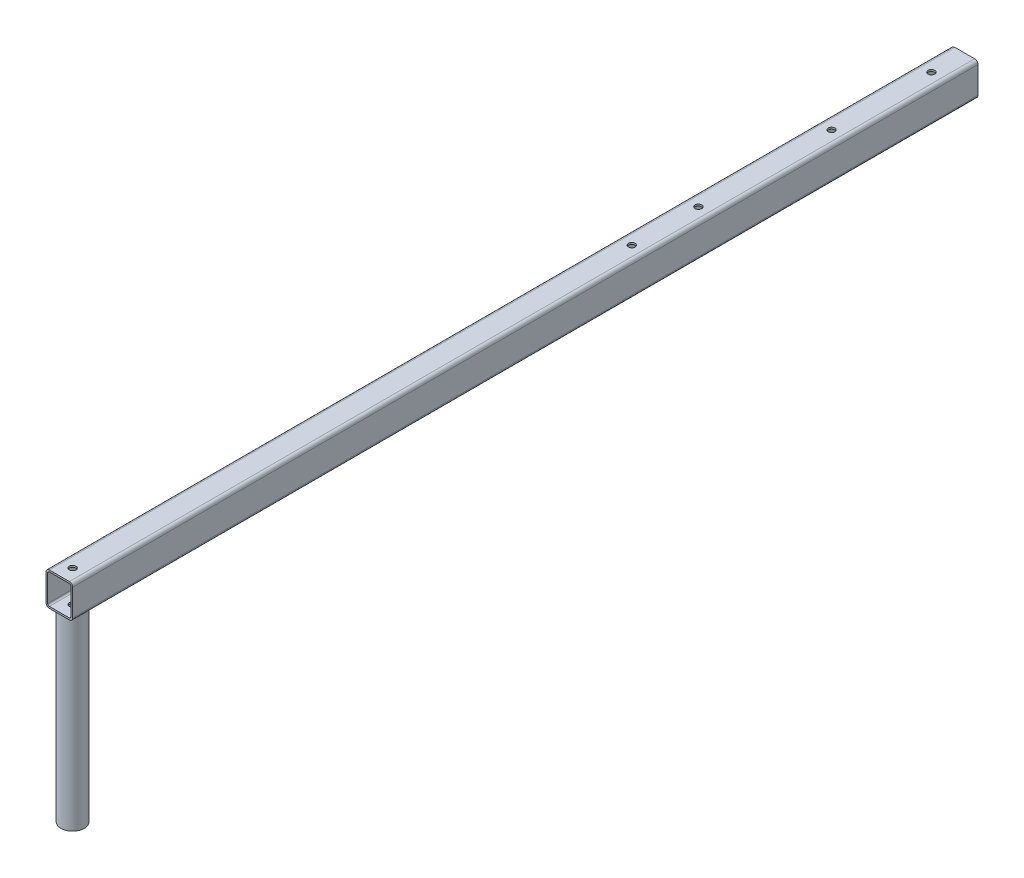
SolidWorks part; units mm, degrees
ref_plane "Front Plane" through (0, 0, 0) normal (0, 0, 1) x (1, 0, 0)
ref_plane "Top Plane" through (0, 0, 0) normal (0, 1, 0) x (1, 0, 0)
ref_plane "Right Plane" through (0, 0, 0) normal (1, 0, 0) x (0, 0, -1)
sketch "Sketch1" plane through (0, 0, 0) normal (0, 0, 1) x (1, 0, 0)
  line L1 (12.7, 15.875) -> (-12.7, 15.875)
  line L2 (12.7, 15.875) -> (12.7, -15.875)
  line L3 (12.7, -15.875) -> (-12.7, -15.875)
  line L4 (-12.7, 15.875) -> (-12.7, -15.875)
  line L5 (12.7, 15.875) -> (-12.7, -15.875) construction
  line L6 (12.7, -15.875) -> (-12.7, 15.875) construction
  point P0 (0, 0)
  dimension "D1" = 25.4
  dimension "D2" = 31.75
extrude "Extrude-Thin1" add sketch "Sketch1" along normal blind 863.6 thin
fillet "Fillet1" radius 3.175 4 edges at (12.7, -15.875, 431.8) (-12.7, -15.875, 431.8) (-12.7, 15.875, 431.8) (12.7, 15.875, 431.8)
fillet "Fillet2" radius 1.5748 4 edges at (11.049, 14.224, 431.8) (11.049, -14.224, 431.8) (-11.049, -14.224, 431.8) (-11.049, 14.224, 431.8)
sketch "Sketch2" plane through (0, 0, 0) normal (0, 1, 0) x (1, 0, 0)
  circle A0 centre (0, -850.9) radius 11.1125
  dimension "D1" = 22.225
  dimension "D2" = 850.9
extrude "Extrude-Thin2" add sketch "Sketch2" against normal blind 177.8 from offset 15.875 separate body thin
sketch "Sketch3" plane through (0, 0, 0) normal (0, 1, 0) x (1, 0, 0)
  circle A0 centre (0, -31.75) radius 3.175
  circle A1 centre (0, -127) radius 3.175
  circle A2 centre (0, -254) radius 3.175
  circle A3 centre (0, -317.5) radius 3.175
  dimension "D1" = 6.35
  dimension "D2" = 31.75
  dimension "D3" = 95.25
  dimension "D4" = 63.5
  dimension "D5" = 254
extrude "Cut-Extrude1" cut sketch "Sketch3" against normal mid plane 50.8
sketch "Sketch4" plane through (0, 15.875, 0) normal (0, 1, 0) x (1, 0, 0)
  circle A0 centre (0, -850.9) radius 11.1125 construction
  circle A1 centre (0, -850.9) radius 11.1125 construction
  circle A2 centre (0, -850.9) radius 3.175
  dimension "D1" = 6.35
extrude "Cut-Extrude2" cut sketch "Sketch4" against normal blind 44.45
